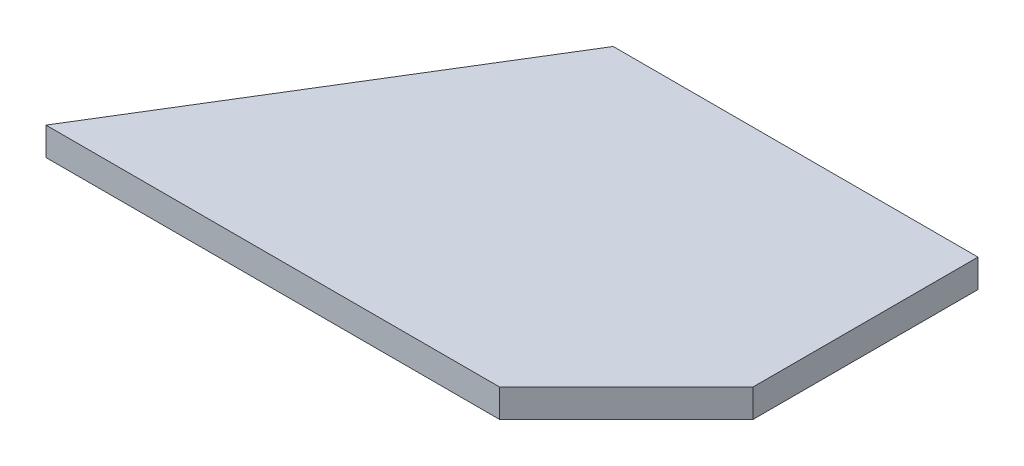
SolidWorks part; units mm, degrees
ref_plane "FRONT" through (0, 0, 0) normal (0, 0, 1) x (1, 0, 0)
ref_plane "TOP" through (0, 0, 0) normal (0, 1, 0) x (1, 0, 0)
ref_plane "RIGHT" through (0, 0, 0) normal (1, 0, 0) x (0, 0, -1)
sketch "Sketch1" plane through (0, 0, 0) normal (0, 1, 0) x (1, 0, 0)
  line L0 (0, 0) -> (-82.3277, 0)
  line L1 (-82.3277, 0) -> (-130.9688, -79.375)
  line L2 (-130.9688, -79.375) -> (-28.575, -79.375)
  line L3 (-28.575, -79.375) -> (0, -50.8)
  line L4 (0, -50.8) -> (0, 0)
  dimension "D1" = 79.375
  dimension "D2" = 50.8
  dimension "D3" = 45
  dimension "D4" = 130.9688
  dimension "D5" = 58.5
extrude "Boss-Extrude1" add sketch "Sketch1" along normal mid plane 6.35
